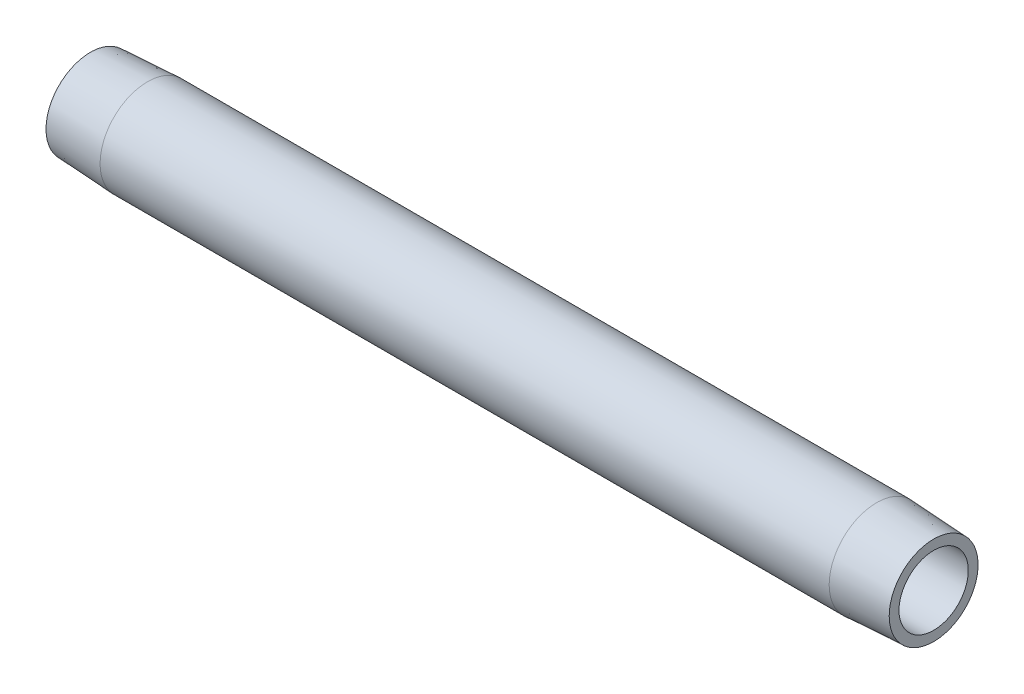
SolidWorks part; units mm, degrees
ref_plane "Front Plane" through (0, 0, 0) normal (0, 0, 1) x (1, 0, 0)
ref_plane "Top Plane" through (0, 0, 0) normal (0, 1, 0) x (1, 0, 0)
ref_plane "Right Plane" through (0, 0, 0) normal (1, 0, 0) x (0, 0, -1)
sketch "Sketch1" plane through (0, 0, 0) normal (0, 0, 1) x (1, 0, 0)
  line L5 (152.4, 6.2611) -> (0, 6.2611)
  line L6 (142.0876, 8.5725) -> (10.3124, 8.5725)
  line L7 (10.3124, 8.5725) -> (0, 8.0321)
  line L8 (152.4, 8.0321) -> (142.0876, 8.5725)
  line L9 (152.4, 6.2611) -> (152.4, 8.0321)
  line L10 (0, 6.2611) -> (0, 8.0321)
  line L11 (0, 0) -> (50000, 0) construction
  line L12 (0, -55) -> (0, 55) construction
  dimension "D1" = 12.5222
  dimension "D2" = 17.145
  dimension "D3" = 3
  dimension "D4" = 3
  dimension "D5" = 152.4
  dimension "D6" = 10.3124
  dimension "D7" = 10.3124
revolve "Revolve1" add sketch "Sketch1" angle 360 about L11
